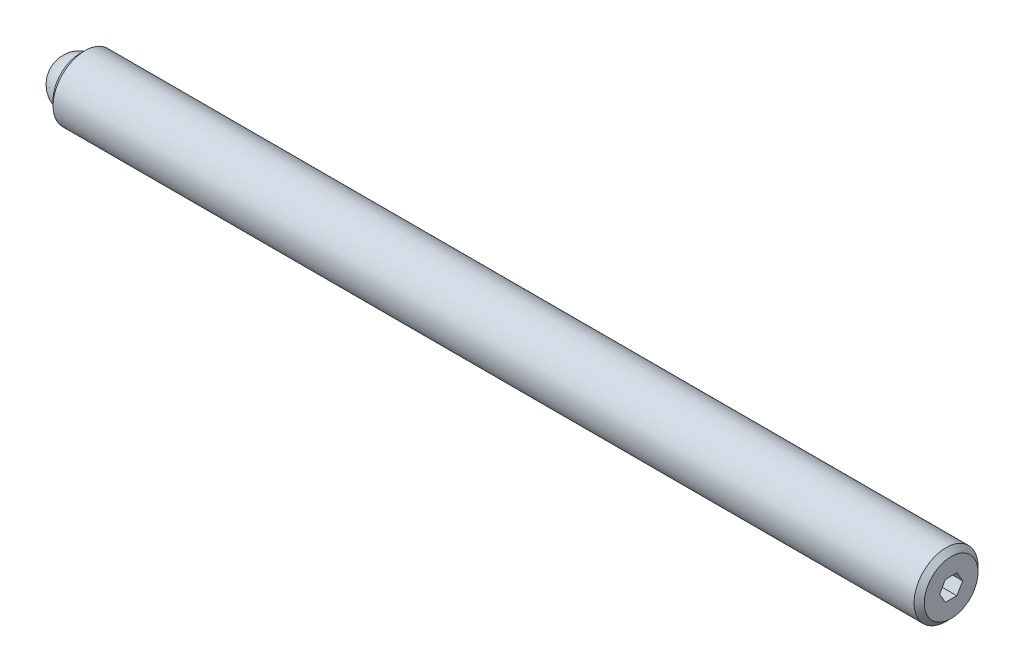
SolidWorks part; units mm, degrees
ref_plane "Front Plane" through (0, 0, 0) normal (0, 0, 1) x (1, 0, 0)
ref_plane "Top Plane" through (0, 0, 0) normal (0, 1, 0) x (1, 0, 0)
ref_plane "Right Plane" through (0, 0, 0) normal (1, 0, 0) x (0, 0, -1)
sketch "Sketch2" plane through (0, 0, 0) normal (1, 0, 0) x (0, 0, -1)
  circle A0 centre (0, 0) radius 3.175
  dimension "D1" = 6.35
extrude "Boss-Extrude1" add sketch "Sketch2" along normal blind 86.5187
sketch "Sketch3" plane through (0, 0, 0) normal (-1, 0, 0) x (0, 0, 1)
  circle A0 centre (0, 0) radius 2.3813
  dimension "D1" = 4.7625
chamfer "Chamfer1" distance 0.508 angle 45 1 edges at (0, 0, -3.175)
chamfer "Chamfer2" distance 0.508 angle 45 1 edges at (86.5187, 0, -3.175)
sketch "Sketch4" plane through (86.5187, 0, 0) normal (1, 0, 0) x (0, 0, -1)
  line L1 (1.1457, 0) -> (0.5728, 0.9922)
  line L2 (0.5728, 0.9922) -> (-0.5728, 0.9922)
  line L3 (-0.5728, 0.9922) -> (-1.1457, 0)
  line L4 (-1.1457, 0) -> (-0.5728, -0.9922)
  line L5 (-0.5728, -0.9922) -> (0.5728, -0.9922)
  line L6 (0.5728, -0.9922) -> (1.1457, 0)
  circle A0 centre (0, 0) radius 0.9922 construction
  dimension "D1" = 1.9844
extrude "Cut-Extrude2" cut sketch "Sketch4" against normal blind 2.286
extrude "Cut-Extrude3" cut sketch "Sketch3" against normal blind 1.9844
sketch "Sketch5" plane through (0, 0, 0) normal (-1, 0, 0) x (0, 0, 1)
  line L0 (0, 0) -> (0, -2.3813)
  line L1 (0, 0) -> (0, 2.3813)
  arc A0 (0, 2.3813) -> (0, -2.3813) centre (0, 0) ccw
  dimension "D1" = 2.3813
revolve "Revolve1" add sketch "Sketch5" angle 360 about L1
